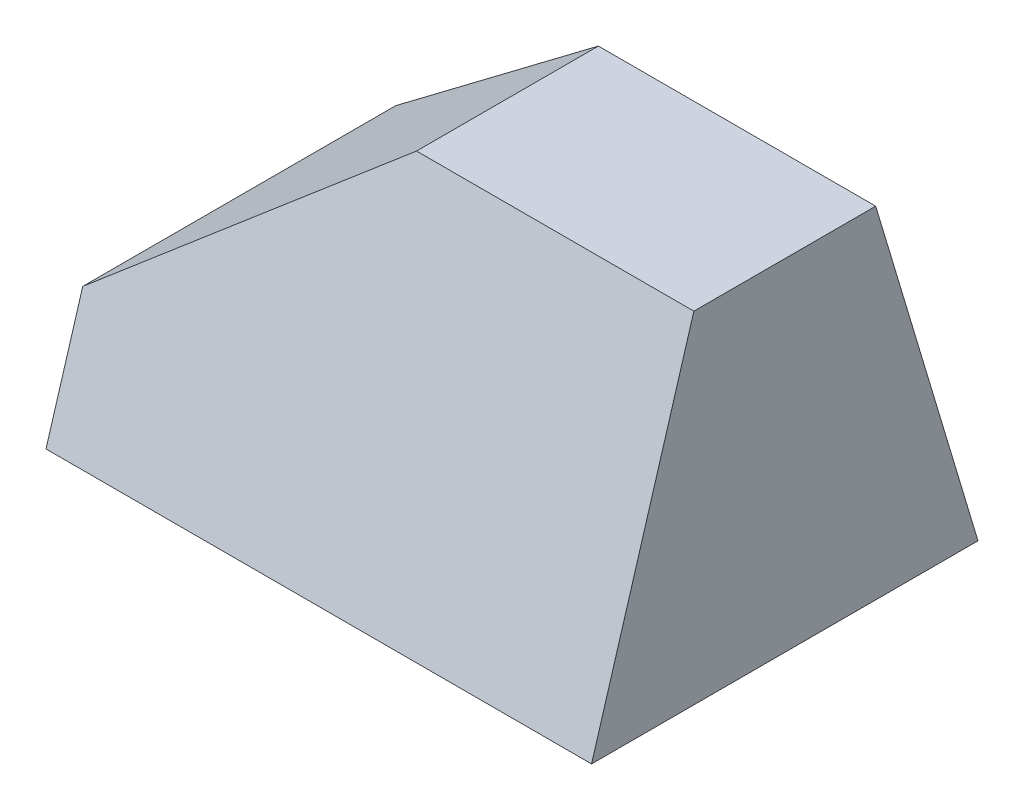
SolidWorks part; units mm, degrees
ref_plane "前视基准面" through (0, 0, 0) normal (0, 0, 1) x (1, 0, 0)
ref_plane "上视基准面" through (0, 0, 0) normal (0, 1, 0) x (1, 0, 0)
ref_plane "右视基准面" through (0, 0, 0) normal (1, 0, 0) x (0, 0, -1)
sketch "草图1" plane through (0, 0, 0) normal (1, 0, 0) x (0, 0, -1)
  line L0 (-42.5, 0) -> (42.5, 0)
  line L1 (42.5, 0) -> (20, 75)
  line L2 (20, 75) -> (-20, 75)
  line L3 (-20, 75) -> (-42.5, 0)
  line L4 (0, -59.4126) -> (0, 96.3448) construction
  dimension "D1" = 75
  dimension "D2" = 40
  dimension "D3" = 85
extrude "拉伸1" add sketch "草图1" along normal blind 120
sketch "草图3" plane through (0, 0, 0) normal (0, 0, 1) x (1, 0, 0)
  line L0 (70.2621, 84.1759) -> (-15.4759, 14.3276)
  line L1 (-15.4759, 14.3276) -> (-15.4759, 84.1759)
  line L2 (-15.4759, 84.1759) -> (70.2621, 84.1759)
extrude "切除-拉伸2" cut sketch "草图3" against normal mid plane 100
